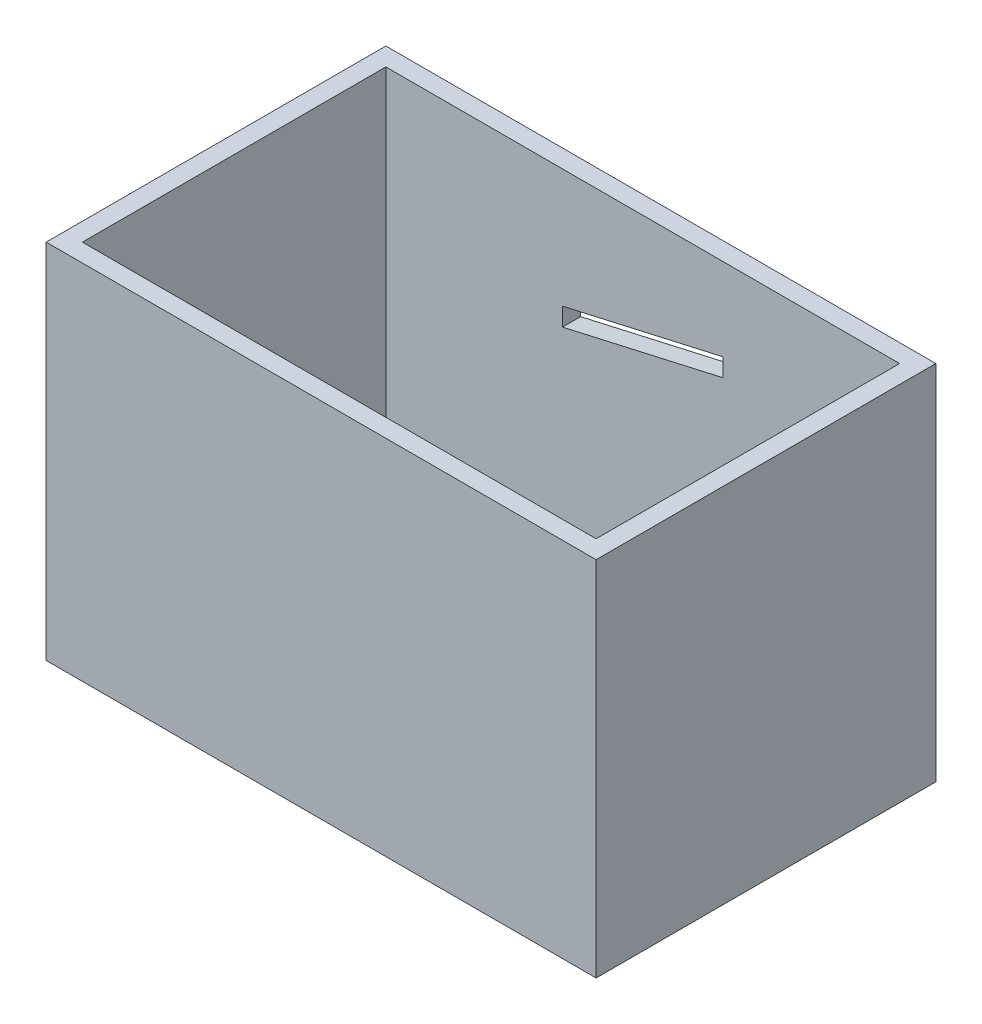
SolidWorks part; units mm, degrees
ref_plane "Спереди" through (0, 0, 0) normal (0, 0, 1) x (1, 0, 0)
ref_plane "Сверху" through (0, 0, 0) normal (0, 1, 0) x (1, 0, 0)
ref_plane "Справа" through (0, 0, 0) normal (1, 0, 0) x (0, 0, -1)
sketch "Эскиз1" plane through (0, 0, 0) normal (0, 1, 0) x (1, 0, 0)
  line L0 (-70.9048, 41.8863) -> (70.9048, 41.8863)
  line L1 (-75.9048, -46.8863) -> (75.9048, -46.8863)
  line L2 (-75.9048, -46.8863) -> (-75.9048, 46.8863)
  line L3 (-75.9048, 46.8863) -> (75.9048, 46.8863)
  line L4 (75.9048, -46.8863) -> (75.9048, 46.8863)
  line L5 (-75.9048, -46.8863) -> (75.9048, 46.8863) construction
  line L6 (-75.9048, 46.8863) -> (75.9048, -46.8863) construction
  line L7 (70.9048, -41.8863) -> (70.9048, 41.8863)
  line L8 (-70.9048, -41.8863) -> (70.9048, -41.8863)
  line L9 (-70.9048, -41.8863) -> (-70.9048, 41.8863)
  point P0 (0, 0)
  dimension "D1" = 5
extrude "Бобышка-Вытянуть1" add sketch "Эскиз1" along normal blind 100
other "Полость1"
other "Деталь2<1>@Сборка11"
